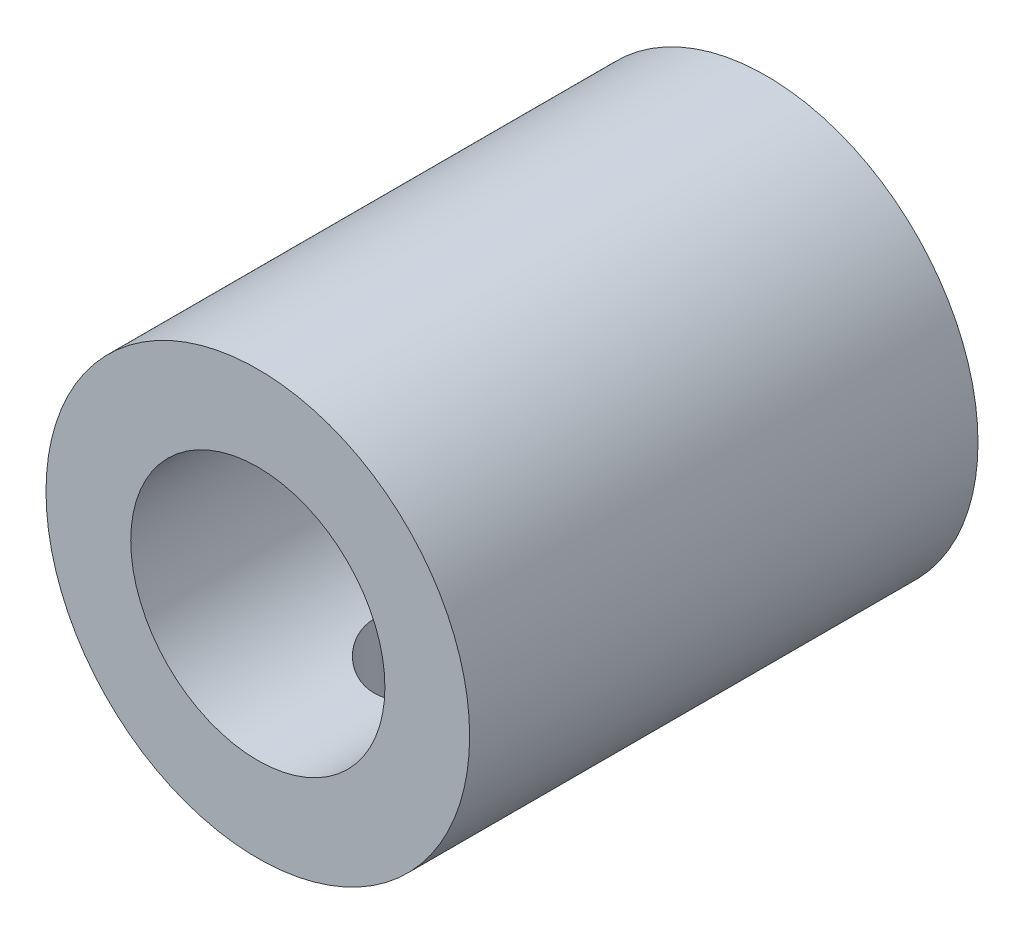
SolidWorks part; units mm, degrees
ref_plane "前视基准面" through (0, 0, 0) normal (0, 0, 1) x (1, 0, 0)
ref_plane "上视基准面" through (0, 0, 0) normal (0, 1, 0) x (1, 0, 0)
ref_plane "右视基准面" through (0, 0, 0) normal (1, 0, 0) x (0, 0, -1)
sketch "草图1" plane through (0, 0, 0) normal (0, 0, 1) x (1, 0, 0)
  circle A0 centre (0, 0) radius 50
  circle A1 centre (0, 0) radius 30
  dimension "D1" = 100
  dimension "D2" = 60
extrude "拉伸1" add sketch "草图1" along normal blind 120
sketch "草图2" plane through (0, 0, 0) normal (0, 1, 0) x (1, 0, 0)
  line L0 (0, 0) -> (0, -113.7976) construction
  circle A0 centre (0, -80) radius 12.5
  dimension "D1" = 25
  dimension "D2" = 80
extrude "切除-拉伸1" cut sketch "草图2" against normal blind 80
